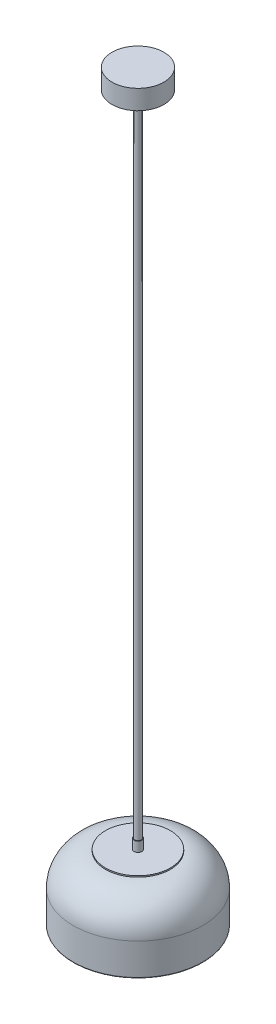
SolidWorks part; units mm, degrees
ref_plane "Alzado" through (0, 0, 0) normal (0, 0, 1) x (1, 0, 0)
ref_plane "Planta" through (0, 0, 0) normal (0, 1, 0) x (1, 0, 0)
ref_plane "Vista lateral" through (0, 0, 0) normal (1, 0, 0) x (0, 0, -1)
sketch "Croquis1" plane through (0, 0, 0) normal (0, 0, 1) x (1, 0, 0)
  line L0 (0, 30) -> (0, -70)
  line L1 (50, 30) -> (0, 30)
  line L2 (100, -20) -> (100, -70)
  line L3 (100, -70) -> (0, -70)
  line L5 (100, 30) -> (0, 0) construction
  line L6 (100, -70) -> (0, 0) construction
  arc A0 (50, 30) -> (100, -20) centre (50, -20) cw
  point P0 (0, 0)
  dimension "D3" = 50
  dimension "D1" = 100
  dimension "D2" = 100
revolve "Revolución1" add sketch "Croquis1" angle 360 about L0
shell "Vaciado1" thickness 3
fillet "Redondeo1" radius 1.5 2 edges at (-100, -70, 0) (-97, -70, 0)
sketch "Croquis2" plane through (0, 27, 0) normal (0, -1, 0) x (1, 0, 0)
  circle A0 centre (0, 0) radius 50
  dimension "D1" = 100
extrude "Saliente-Extruir1" add sketch "Croquis2" along normal blind 2 separate body
sketch "Croquis3" plane through (0, 25, 0) normal (0, -1, 0) x (1, 0, 0)
  circle A1 centre (0, 0) radius 50
  circle A2 centre (0, 0) radius 50
  dimension "D1" = 0
extrude "Saliente-Extruir2" add sketch "Croquis3" along normal blind 20 separate body
sketch "Croquis4" plane through (0, 5, 0) normal (0, -1, 0) x (1, 0, 0)
  circle A1 centre (0, 0) radius 50
  circle A2 centre (0, 0) radius 50
  dimension "D1" = 0
extrude "Saliente-Extruir3" add sketch "Croquis4" along normal blind 15 separate body
fillet "Redondeo2" radius 10 1 edges at (0, -10, -50)
sketch "Croquis5" plane through (0, 30, 0) normal (0, 1, 0) x (1, 0, 0)
  circle A0 centre (0, 0) radius 50
  dimension "D1" = 100
extrude "Saliente-Extruir4" add sketch "Croquis5" along normal blind 2 separate body
sketch "Croquis6" plane through (0, 32, 0) normal (0, 1, 0) x (1, 0, 0)
  circle A0 centre (0, 0) radius 6
  dimension "D1" = 12
extrude "Saliente-Extruir5" add sketch "Croquis6" along normal blind 15
sketch "Croquis7" plane through (0, 47, 0) normal (0, 1, 0) x (1, 0, 0)
  circle A0 centre (0, 0) radius 5
  dimension "D1" = 10
extrude "Saliente-Extruir6" add sketch "Croquis7" along normal blind 1000
sketch "Croquis8" plane through (0, 1047, 0) normal (0, 1, 0) x (1, 0, 0)
  circle A0 centre (0, 0) radius 40
  dimension "D1" = 80
extrude "Saliente-Extruir7" add sketch "Croquis8" along normal blind 30
